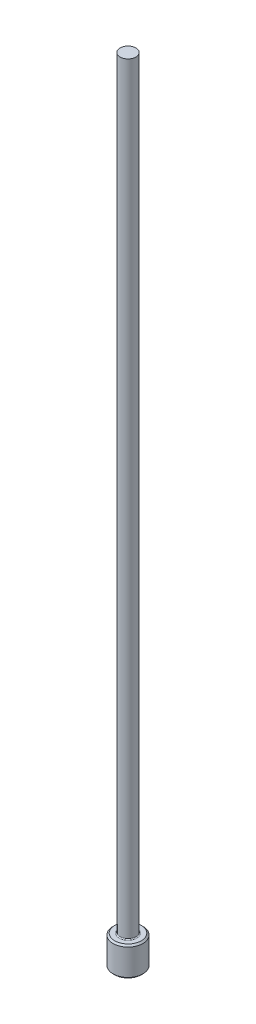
SolidWorks part; units mm, degrees
ref_plane "Front Plane" through (0, 0, 0) normal (0, 0, 1) x (1, 0, 0)
ref_plane "Top Plane" through (0, 0, 0) normal (0, 1, 0) x (1, 0, 0)
ref_plane "Right Plane" through (0, 0, 0) normal (1, 0, 0) x (0, 0, -1)
other "Configuration Table"
sketch "Sketch1" plane through (0, 0, 0) normal (0, 0, 1) x (1, 0, 0)
  line L0 (0, 259.9588) -> (0, -15.1925) construction
  line L1 (0, 0) -> (-1.1938, 0)
  line L2 (-1.1938, 0) -> (-1.1938, 2.3622)
  line L3 (-1.1938, 2.3622) -> (-0.635, 2.3622)
  line L4 (-0.635, 2.3622) -> (-0.635, 63.5)
  line L5 (-0.635, 63.5) -> (0, 63.5)
  line L6 (0, 63.5) -> (0, 0)
  dimension "L" = 63.5
  dimension "H" = 2.3876
  dimension "T" = 2.3622
  dimension "D" = 1.27
revolve "Revolve1" add sketch "Sketch1" angle 360 about L0
chamfer "Chamfer1" distance 0.127 angle 45 2 edges at (0, 2.3622, 1.1938) (0, 0, 1.1938)
fillet "Fillet1" radius 0.0762 1 edges at (0, 2.3622, 0.635)
